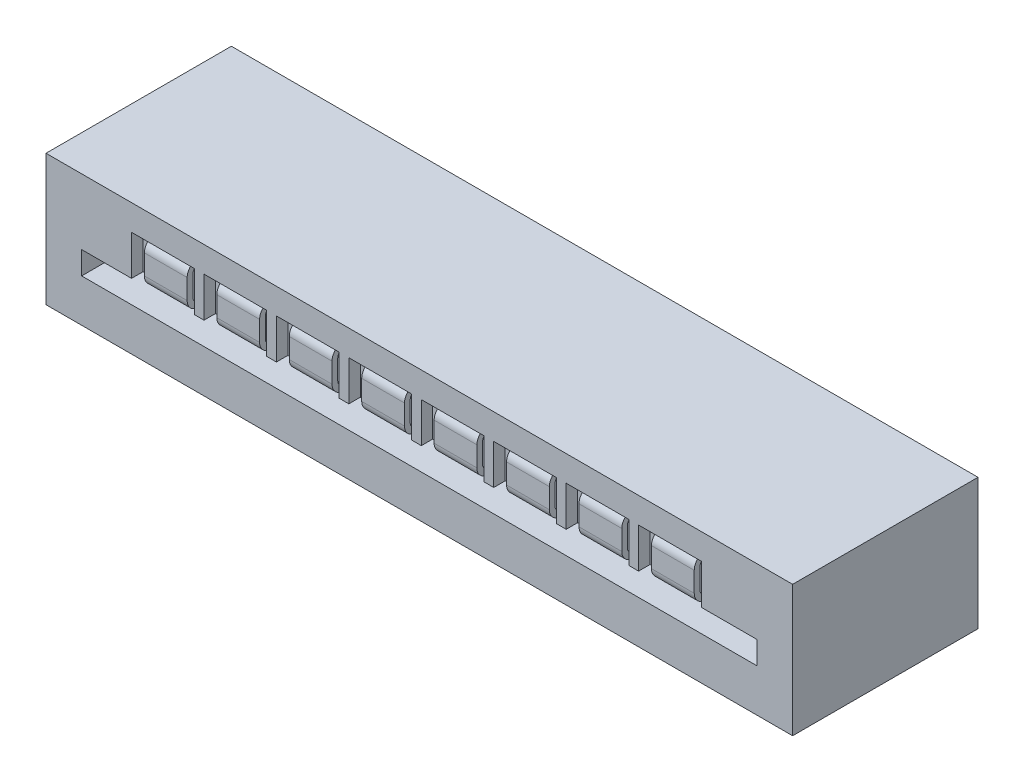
SolidWorks part; units mm, degrees
ref_plane "Front" through (0, 0, 0) normal (0, 0, 1) x (1, 0, 0)
ref_plane "Top" through (0, 0, 0) normal (0, 1, 0) x (1, 0, 0)
ref_plane "Right" through (0, 0, 0) normal (1, 0, 0) x (0, 0, -1)
sketch "Эскиз1" plane through (0, 0, 0) normal (0, 0, 1) x (1, 0, 0)
  line L1 (-13.09, 0) -> (13.09, 0)
  line L2 (-13.09, 0) -> (-13.09, 4.6)
  line L3 (-13.09, 4.6) -> (13.09, 4.6)
  line L4 (13.09, 0) -> (13.09, 4.6)
  dimension "A" = 26.18
  dimension "D2" = 4.6
extrude "Вытянуть1" add sketch "Эскиз1" against normal blind 6.5
sketch "Эскиз2" plane through (0, 0, 0) normal (0, 0, 1) x (1, 0, 0)
  line L0 (0, 1.5) -> (0, 0) construction
  line L1 (-11.84, 1.5) -> (11.84, 1.5)
  line L2 (-11.84, 1.5) -> (-11.84, 2.3)
  line L3 (-11.84, 2.3) -> (11.84, 2.3)
  line L4 (11.84, 1.5) -> (11.84, 2.3)
  line L5 (-13.09, 0) -> (13.09, 0) construction
  line L6 (-13.09, 4.6) -> (-13.09, 0) construction
  dimension "D1" = 0.8
  dimension "D2" = 1.5
  dimension "D3" = 1.25
  dimension "D4" = 23.68
extrude "Вытянуть2" cut sketch "Эскиз2" against normal blind 5.5
ref_plane "Плоскость1" through (-8.99, 0, 0) normal (-1, 0, 0) x (0, 0, 1)
sketch "Эскиз3" plane through (-8.99, 0, 0) normal (-1, 0, 0) x (0, 0, 1)
  line L0 (-6.5, 4.6) -> (-6.5, 0) construction
  line L1 (0, 2.3) -> (-0.4, 2.3)
  line L2 (0, 2.3) -> (0, 3.7)
  line L3 (0, 3.7) -> (-0.4, 3.7)
  line L4 (-0.4, 2.3) -> (-0.4, 3.7)
  line L5 (-6.5, 3.7) -> (-5.7, 3.7)
  line L6 (-6.5, 3.7) -> (-6.5, 0)
  line L7 (-6.5, 0) -> (-5.7, 0)
  line L8 (-5.7, 3.7) -> (-5.7, 0)
  line L9 (-6.5, 0) -> (0, 0) construction
  line L10 (-6.5, 4.6) -> (0, 4.6) construction
  dimension "D1" = 0.4
  dimension "D2" = 0.9
  dimension "D3" = 0.8
extrude "Вытянуть3" cut sketch "Эскиз3" against normal mid plane 2.2
sketch "Эскиз4" plane through (-8.99, 0, 0) normal (-1, 0, 0) x (0, 0, 1)
  line L0 (-2.1, 2.3) -> (-0.5, 2.3)
  line L1 (-0.3, 2.5) -> (-0.3, 3.2)
  line L2 (-0.5, 3.4) -> (-5.6, 3.4)
  line L3 (-5.8, 3.2) -> (-5.8, 0.4)
  line L4 (-6.2, 0) -> (-7.7, 0)
  line L5 (-6.5, 4.6) -> (-6.5, 0) construction
  line L6 (-2.1, 2.1) -> (-0.5, 2.1)
  line L7 (-0.1, 2.5) -> (-0.1, 3.2)
  line L8 (-0.5, 3.6) -> (-5.6, 3.6)
  line L9 (-6, 3.2) -> (-6, 0.4)
  line L10 (-6.2, 0.2) -> (-7.7, 0.2)
  line L11 (-2.1, 2.1) -> (-2.1, 2.3)
  line L12 (-7.7, 0) -> (-7.7, 0.2)
  line L13 (-5.7, 3.7) -> (-6.5, 3.7) construction
  line L14 (-5.7, 0) -> (-5.7, 3.7) construction
  line L15 (-0.4, 3.7) -> (-0.4, 2.3) construction
  line L16 (-5.5, 2.3) -> (0, 2.3) construction
  arc A0 (-0.5, 2.3) -> (-0.3, 2.5) centre (-0.5, 2.5) ccw
  arc A1 (-0.3, 3.2) -> (-0.5, 3.4) centre (-0.5, 3.2) ccw
  arc A2 (-5.6, 3.4) -> (-5.8, 3.2) centre (-5.6, 3.2) ccw
  arc A3 (-5.8, 0.4) -> (-6.2, 0) centre (-6.2, 0.4) cw
  arc A4 (-0.5, 2.1) -> (-0.1, 2.5) centre (-0.5, 2.5) ccw
  arc A5 (-0.1, 3.2) -> (-0.5, 3.6) centre (-0.5, 3.2) ccw
  arc A6 (-5.6, 3.6) -> (-6, 3.2) centre (-5.6, 3.2) ccw
  arc A7 (-6, 0.4) -> (-6.2, 0.2) centre (-6.2, 0.4) cw
  arc A8 (-5.8, 0.4) -> (-6.2, 0) centre (-6.2, 0.4) cw construction
  dimension "D2" = 0.2
  dimension "D3" = 0.4
  dimension "D1" = 1.2
  dimension "D5" = 0.1
  dimension "D6" = 0.1
  dimension "D7" = 0.1
  dimension "D8" = 2
  dimension "D4" = 0.2
extrude "Вытянуть4" add sketch "Эскиз4" along normal mid plane 1.5
sketch "Эскиз5" plane through (0, 0, -5.7) normal (0, 0, -1) x (-1, 0, 0)
  line L0 (7.89, 0) -> (10.09, 0) construction
  line L1 (8.24, 0) -> (8.69, 0)
  line L2 (8.24, 0) -> (8.24, 2.4)
  line L3 (8.24, 2.4) -> (8.69, 1.95)
  line L4 (8.69, 0) -> (8.69, 1.95)
  line L5 (8.99, 0) -> (8.99, 3.5873) construction
  line L6 (9.74, 0) -> (8.24, 0) construction
  line L7 (9.74, 3.5873) -> (8.24, 3.5873) construction
  line L8 (8.24, 3.2) -> (8.24, 0.4) construction
  line L9 (9.29, 0) -> (9.29, 1.95)
  line L10 (9.74, 2.4) -> (9.29, 1.95)
  line L11 (9.74, 0) -> (9.74, 2.4)
  line L12 (9.74, 0) -> (9.29, 0)
  dimension "D1" = 0.6
  dimension "D2" = 45
  dimension "D3" = 2.4
extrude "Вытянуть5" cut sketch "Эскиз5" along normal through all
pattern_linear "Линейный массив1" count 8 spacing 2.54 along (1, 0, 0) of "Вытянуть3"
pattern_linear "Линейный массив2" count 8 spacing 2.54 along (1, 0, 0) of "Вытянуть4", "Вытянуть5"
equation "\"A@Эскиз1\" =  (  ( \"N1@Линейный массив1\" - 1 )  * 2.54 )  + 8.4"
equation "\"N2@Линейный массив2\" = \"N1@Линейный массив1\""
